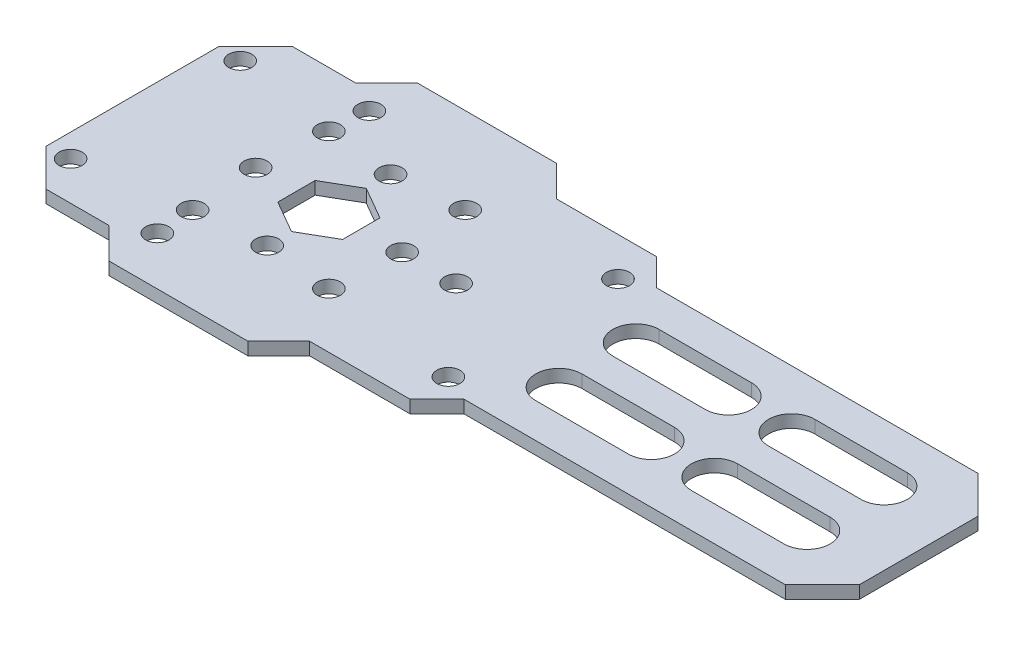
SolidWorks part; units mm, degrees
ref_plane "Front Plane" through (0, 0, 0) normal (0, 0, 1) x (1, 0, 0)
ref_plane "Top Plane" through (0, 0, 0) normal (0, 1, 0) x (1, 0, 0)
ref_plane "Right Plane" through (0, 0, 0) normal (1, 0, 0) x (0, 0, -1)
sketch "Sketch1" plane through (0, 0, 0) normal (0, 1, 0) x (1, 0, 0)
  line L0 (130.2501, 16.034) -> (-172.9457, 16.034) construction
  line L1 (-71.3478, 32.034) -> (-88.3478, 32.034)
  line L2 (-71.3478, 32.034) -> (-71.3478, 0.034)
  line L3 (-71.3478, 0.034) -> (-88.3478, 0.034)
  line L4 (-88.3478, 32.034) -> (-88.3478, 0.034)
  line L5 (-71.3478, 28.534) -> (-21.3478, 28.534)
  line L6 (-71.3478, 28.534) -> (-71.3478, 3.534)
  line L7 (-71.3478, 3.534) -> (-21.3478, 3.534)
  line L8 (-21.3478, 28.534) -> (-21.3478, 3.534)
  line L9 (-71.3478, 32.034) -> (-67.8478, 28.534)
  line L10 (-88.3478, 36.034) -> (-106.3478, 36.034)
  line L11 (-88.3478, 36.034) -> (-88.3478, -3.966)
  line L12 (-88.3478, -3.966) -> (-106.3478, -3.966)
  line L13 (-106.3478, 36.034) -> (-106.3478, -3.966)
  line L14 (-106.3478, 32.0273) -> (-123.3478, 32.0273)
  line L15 (-106.3478, 32.0273) -> (-106.3478, 0.0273)
  line L16 (-106.3478, 0.0273) -> (-123.3478, 0.0273)
  line L17 (-123.3478, 32.0273) -> (-123.3478, 0.0273)
  line L18 (-88.3478, 36.034) -> (-84.3478, 32.034)
  line L19 (-106.3478, -3.966) -> (-110.341, 0.0273)
  line L20 (-118.5394, 0.0273) -> (-123.3478, 4.8356)
  line L21 (-123.3478, 27.219) -> (-118.5394, 32.0273)
  line L22 (-106.3478, 36.034) -> (-110.3478, 32.0273)
  line L23 (-88.3478, -3.966) -> (-84.3478, 0.034)
  line L24 (-71.3478, 0.034) -> (-67.8478, 3.534)
  line L25 (-26.1561, 3.534) -> (-21.3478, 8.3424)
  line L26 (-26.1561, 28.534) -> (-21.3478, 23.7257)
  point P8 (-88.3478, 16.034)
  point P11 (-21.3478, 16.034)
  dimension "D1" = 25
  dimension "D2" = 50
  dimension "D3" = 17
  dimension "D4" = 0
  dimension "D5" = 32
  dimension "D6" = 0
  dimension "D7" = 18
  dimension "D8" = 40
  dimension "D9" = 20
  dimension "D10" = 0
  dimension "D11" = 32
  dimension "D12" = 17
  dimension "D13" = 45
  dimension "D14" = 45
  dimension "D15" = 45
  dimension "D16" = 45
  dimension "D17" = 6.8
  dimension "D18" = 45
  dimension "D19" = 45
  dimension "D20" = 6.8
  dimension "D21" = 6.8
  dimension "D22" = 6.8
  dimension "D23" = 45
  dimension "D24" = 45.048
  dimension "D25" = 45
  dimension "D26" = 45
extrude "Boss-Extrude1" add sketch "Sketch1" along normal blind 1.65 contours L15 L0 L17 L20 L16 | L0 L13 L14 L21 L17 | L0 L4 L11 L10 L13 | L11 L0 L15 L13 L12 | L6 L0 L11 L3 L2 | L0 L2 L1 L4 | L0 L8 L26 L5 L2 | L8 L0 L6 L7 L25 | L2 L24 L7 | L11 L23 L3 | L19 L13 L16 | L13 L22 L14 | L18 L11 L1 | L9 L2 L5
sketch "Sketch2" plane through (0, 1.65, 0) normal (0, 1, 0) x (1, 0, 0)
  line L0 (-242.0102, 16.0273) -> (-4.6854, 16.0273) construction
  line L2 (-97.8478, -983.9727) -> (-97.8478, 49016.0273) construction
  line L3 (-804.9546, -691.0795) -> (34550.3845, 34664.2596) construction
  line L4 (609.259, -691.0795) -> (-34746.0801, 34664.2596) construction
  line L5 (-120.3478, -985.592) -> (-120.3478, 49014.408) construction
  line L6 (-71.3478, -986.0116) -> (-71.3478, 49013.9884) construction
  line L7 (-106.3478, -986.4312) -> (-106.3478, 49013.5688) construction
  line L8 (-21.3478, 23.7257) -> (-21.3478, 8.3424) construction
  line L9 (-97.8478, 20.8773) -> (-102.048, 18.4523)
  line L10 (-102.048, 18.4523) -> (-102.048, 13.6023)
  line L11 (-102.048, 13.6023) -> (-97.8478, 11.1773)
  line L12 (-97.8478, 11.1773) -> (-93.6476, 13.6023)
  line L13 (-93.6476, 13.6023) -> (-93.6476, 18.4523)
  line L14 (-93.6476, 18.4523) -> (-97.8478, 20.8773)
  line L15 (-1071.3478, 27.0273) -> (48928.6522, 27.0273) construction
  line L16 (-1071.3478, 5.0273) -> (48928.6522, 5.0273) construction
  line L17 (-1048.6303, 21.0273) -> (48951.3697, 21.0273) construction
  line L18 (-1048.6303, 11.0273) -> (48951.3697, 11.0273) construction
  line L19 (-63.0189, 21.0273) -> (-51.0189, 21.0273) construction
  line L20 (-63.0189, 24.0273) -> (-51.0189, 24.0273)
  line L21 (-63.0189, 18.0273) -> (-51.0189, 18.0273)
  line L22 (-63.0189, -978.9727) -> (-63.0189, 49021.0273) construction
  line L23 (-51.0189, -978.9727) -> (-51.0189, 49021.0273) construction
  line L24 (-63.0189, 11.0273) -> (-51.0189, 11.0273) construction
  line L25 (-63.0189, 14.0273) -> (-51.0189, 14.0273)
  line L26 (-63.0189, 8.0273) -> (-51.0189, 8.0273)
  line L27 (-42.8216, -984.9471) -> (-42.8216, 49015.0529) construction
  line L28 (-42.8216, 21.0273) -> (-30.8216, 21.0273) construction
  line L29 (-42.8216, 24.0273) -> (-30.8216, 24.0273)
  line L30 (-42.8216, 18.0273) -> (-30.8216, 18.0273)
  line L31 (-30.8216, -978.9727) -> (-30.8216, 49021.0273) construction
  line L32 (-42.8216, 11.0273) -> (-30.8216, 11.0273) construction
  line L33 (-42.8216, 14.0273) -> (-30.8216, 14.0273)
  line L34 (-42.8216, 8.0273) -> (-30.8216, 8.0273)
  circle A0 centre (-97.8478, 16.0273) radius 4.2002 construction
  circle A1 centre (-107.3478, 16.0273) radius 1.5
  circle A2 centre (-88.3478, 16.0273) radius 1.5
  circle A3 centre (-97.8478, 24.0273) radius 1.5
  circle A4 centre (-97.8478, 8.0273) radius 1.5
  circle A5 centre (-89.0089, 7.1885) radius 1.5
  circle A6 centre (-106.6866, 24.8661) radius 1.5
  circle A7 centre (-89.0089, 24.8661) radius 1.5
  circle A8 centre (-106.6866, 7.1885) radius 1.5
  circle A9 centre (-81.3478, 16.0273) radius 1.5
  circle A10 centre (-106.3478, 29.7773) radius 1.5
  circle A11 centre (-106.3478, 2.2773) radius 1.5
  circle A12 centre (-71.3478, 27.0273) radius 1.5
  circle A13 centre (-71.3478, 5.0273) radius 1.5
  circle A14 centre (-120.3478, 27.0273) radius 1.5
  circle A15 centre (-120.3478, 5.0273) radius 1.5
  arc A16 (-63.0189, 24.0273) -> (-63.0189, 18.0273) centre (-63.0189, 21.0273) ccw
  arc A17 (-51.0189, 18.0273) -> (-51.0189, 24.0273) centre (-51.0189, 21.0273) ccw
  arc A18 (-63.0189, 14.0273) -> (-63.0189, 8.0273) centre (-63.0189, 11.0273) ccw
  arc A19 (-51.0189, 8.0273) -> (-51.0189, 14.0273) centre (-51.0189, 11.0273) ccw
  arc A20 (-42.8216, 24.0273) -> (-42.8216, 18.0273) centre (-42.8216, 21.0273) ccw
  arc A21 (-30.8216, 18.0273) -> (-30.8216, 24.0273) centre (-30.8216, 21.0273) ccw
  arc A22 (-42.8216, 14.0273) -> (-42.8216, 8.0273) centre (-42.8216, 11.0273) ccw
  arc A23 (-30.8216, 8.0273) -> (-30.8216, 14.0273) centre (-30.8216, 11.0273) ccw
  point P3 (-123.3478, 16.0273)
  point P65 (-57.0189, 21.0273)
  point P76 (-57.0189, 11.0273)
  point P85 (-36.8216, 21.0273)
  point P94 (-36.8216, 11.0273)
  dimension "D2" = 3
  dimension "D3" = 3
  dimension "D6" = 3
  dimension "D7" = 3
  dimension "D10" = 3
  dimension "D11" = 3
  dimension "D14" = 3
  dimension "D15" = 3
  dimension "D19" = 3
  dimension "D22" = 3
  dimension "D23" = 3
  dimension "D27" = 3
  dimension "D28" = 3
  dimension "D32" = 3
  dimension "D33" = 3
  dimension "D1" = 4.85
  dimension "D4" = 9.5
  dimension "D5" = 9.5
  dimension "D8" = 8
  dimension "D9" = 8
  dimension "D12" = 12.5
  dimension "D13" = 12.5
  dimension "D16" = 12.5
  dimension "D17" = 12.5
  dimension "D18" = 76.5
  dimension "D20" = 60
  dimension "D21" = 85
  dimension "D24" = 13.75
  dimension "D25" = 13.75
  dimension "D26" = 50
  dimension "D29" = 11
  dimension "D30" = 11
  dimension "D31" = 99
  dimension "D34" = 5
  dimension "D35" = 5
extrude "Cut-Extrude1" cut sketch "Sketch2" against normal blind 1.65
